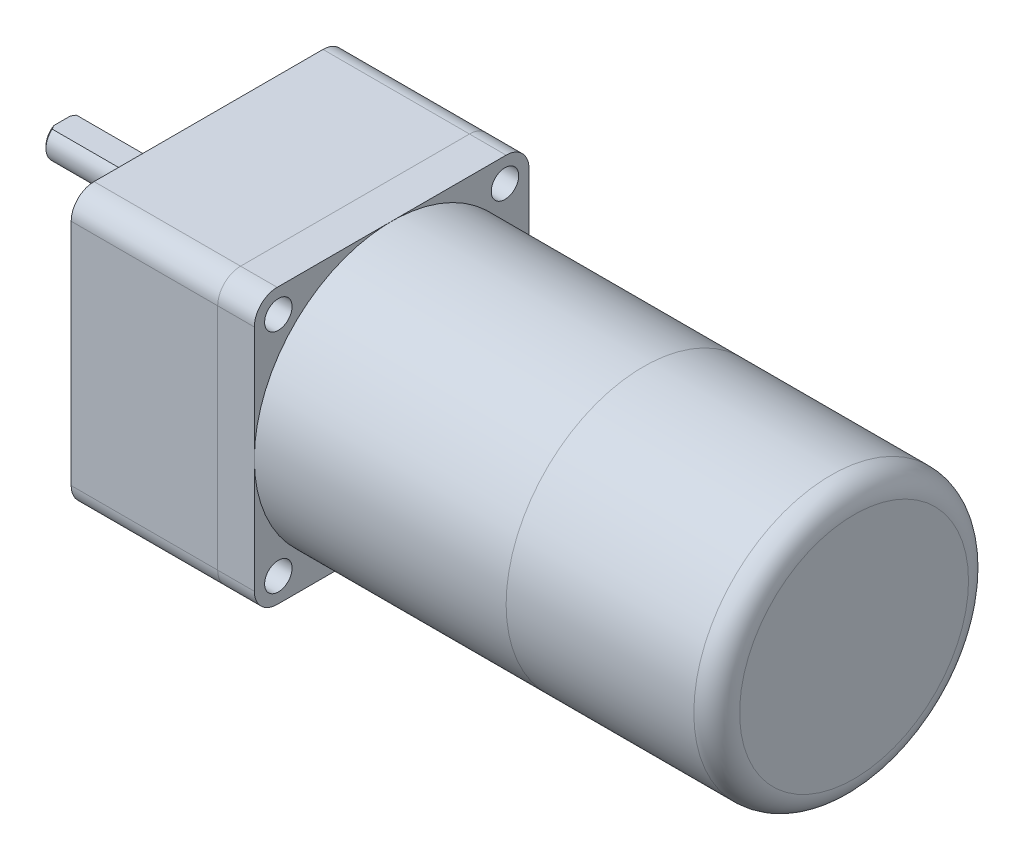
SolidWorks part; units mm, degrees
ref_plane "前视基准面" through (0, 0, 0) normal (0, 0, 1) x (1, 0, 0)
ref_plane "上视基准面" through (0, 0, 0) normal (0, 1, 0) x (1, 0, 0)
ref_plane "右视基准面" through (0, 0, 0) normal (1, 0, 0) x (0, 0, -1)
sketch "草图1" plane through (0, 0, 0) normal (1, 0, 0) x (0, 0, -1)
  line L1 (-25, -30) -> (25, -30)
  line L2 (-30, -25) -> (-30, 25)
  line L3 (-25, 30) -> (25, 30)
  line L4 (30, -25) -> (30, 25)
  line L5 (-30, -30) -> (30, 30) construction
  line L6 (-30, 30) -> (30, -30) construction
  arc A0 (-25, -30) -> (-30, -25) centre (-25, -25) cw
  arc A1 (-30, 25) -> (-25, 30) centre (-25, 25) cw
  arc A2 (25, 30) -> (30, 25) centre (25, 25) cw
  arc A3 (25, -30) -> (30, -25) centre (25, -25) ccw
  point P0 (0, 0)
  dimension "D1" = 5
extrude "凸台-拉伸1" add sketch "草图1" along normal blind 32
sketch "草图2" plane through (32, 0, 0) normal (1, 0, 0) x (0, 0, -1)
  line L0 (25, 30) -> (-25, 30) construction
  line L1 (-25, -30) -> (25, -30)
  line L2 (-30, -25) -> (-30, 25)
  line L3 (-25, 30) -> (25, 30)
  line L4 (30, -25) -> (30, 25)
  line L5 (-30, -30) -> (30, 30) construction
  line L6 (-30, 30) -> (30, -30) construction
  arc A0 (-25, -30) -> (-30, -25) centre (-25, -25) cw
  arc A1 (25, -30) -> (30, -25) centre (25, -25) ccw
  arc A2 (25, 30) -> (30, 25) centre (25, 25) cw
  arc A3 (-30, 25) -> (-25, 30) centre (-25, 25) cw
  point P0 (0, 0)
  dimension "D1" = 5
extrude "凸台-拉伸2" add sketch "草图2" along normal blind 8 separate body
sketch "草图3" plane through (40, 0, 0) normal (1, 0, 0) x (0, 0, -1)
  circle A0 centre (0, 0) radius 30
extrude "凸台-拉伸3" add sketch "草图3" along normal blind 55 separate body
sketch "草图4" plane through (95, 0, 0) normal (1, 0, 0) x (0, 0, -1)
  circle A0 centre (0, 0) radius 30
extrude "凸台-拉伸4" add sketch "草图4" along normal blind 46 separate body
fillet "圆角1" radius 5 1 edges at (141, 0, -30)
sketch "草图5" plane through (0, 0, 0) normal (-1, 0, 0) x (0, 0, 1)
  point P19 (-24.7487, 24.7487)
  point P20 (24.7487, 24.7487)
  point P21 (24.7487, -24.7487)
  point P22 (-24.7487, -24.7487)
hole_wizard "M4 螺纹孔1" positions "3D草图1" profile "草图6" tap size "M4" standard "GB"
sketch3d "3D草图1"
  point P0 (0, 24.7487, -24.7487)
  point P3 (0, 24.7487, 24.7487)
  point P6 (0, -24.7487, 24.7487)
  point P9 (0, -24.7487, -24.7487)
sketch "草图6" plane through (0, 24.7487, -24.7487) normal (0, 1, 0) x (0, 0, 1)
  line L0 (0, 0) -> (0, 12.4914)
  line L1 (0, 12.4914) -> (1.65, 11.5)
  line L2 (1.65, 11.5) -> (1.65, 0)
  line L5 (1.65, 0) -> (0, 0)
  line L10 (0, 12.4914) -> (-1.65, 11.5) construction
  line L11 (0, -6.35) -> (0, 107.95) construction
  dimension "螺纹孔钻头直径" = 3.3
  dimension "螺纹孔钻头深度" = 11.5
  dimension "导头角度" = 118
sketch "草图7" plane through (40, 0, 0) normal (1, 0, 0) x (0, 0, -1)
  circle A1 centre (-24.7487, 24.7487) radius 3
  circle A2 centre (24.7487, 24.7487) radius 3
  circle A3 centre (24.7487, -24.7487) radius 3
  circle A4 centre (-24.7487, -24.7487) radius 3
extrude "切除-拉伸1" cut sketch "草图7" against normal blind 28.5
fillet "圆角2" radius 0.5 4 edges at (0, -24.7487, -23.0987) (0, -24.7487, 26.3987) (0, 24.7487, 26.3987) (0, 24.7487, -23.0987)
sketch "草图8" plane through (0, 0, 0) normal (-1, 0, 0) x (0, 0, 1)
  circle A0 centre (0, 10) radius 12
extrude "凸台-拉伸5" add sketch "草图8" along normal blind 3.3 separate body
fillet "圆角3" radius 0.5 1 edges at (-3.3, 10, 12)
sketch "草图9" plane through (-3.3, 0, 0) normal (-1, 0, 0) x (0, 0, 1)
  circle A0 centre (0, 10) radius 4
extrude "凸台-拉伸6" add sketch "草图9" along normal blind 28.7 separate body
sketch "草图10" plane through (-32, 0, 0) normal (-1, 0, 0) x (0, 0, 1)
  line L2 (2.6458, 13) -> (-2.6458, 13)
  circle A0 centre (0, 10) radius 4 construction
  arc A1 (2.6458, 13) -> (-2.6458, 13) centre (0, 10) ccw
extrude "切除-拉伸2" cut sketch "草图10" against normal blind 25
chamfer "倒角1" distance 0.5 angle 45 1 edges at (-32, 6, 0)
sketch "草图11" plane through (0, 0, 0) normal (-1, 0, 0) x (0, 0, 1)
  circle A0 centre (0, 0) radius 26.3
extrude "切除-拉伸3" cut sketch "草图11" against normal blind 0.5
fillet "圆角4" radius 0.5 1 edges at (0, 0, 26.3)
